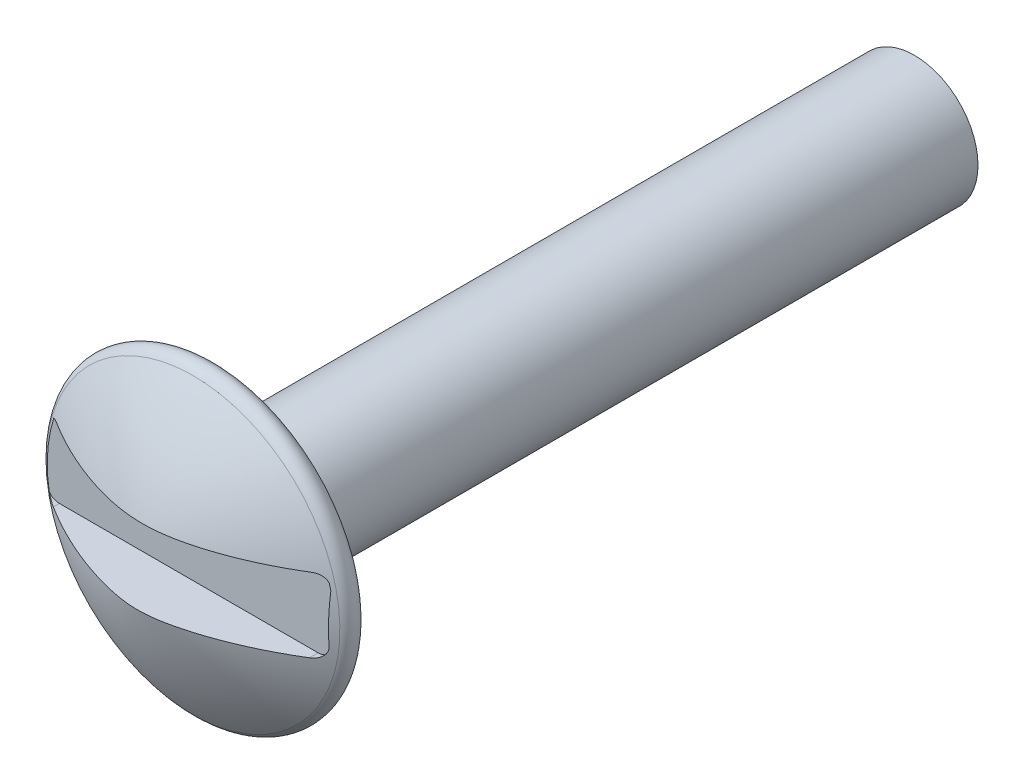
SolidWorks part; units mm, degrees
ref_plane "Front Plane" through (0, 0, 0) normal (0, 0, 1) x (1, 0, 0)
ref_plane "Top Plane" through (0, 0, 0) normal (0, 1, 0) x (1, 0, 0)
ref_plane "Right Plane" through (0, 0, 0) normal (1, 0, 0) x (0, 0, -1)
sketch "Sketch1" plane through (0, 0, 0) normal (0, 0, 1) x (1, 0, 0)
  circle A0 centre (0, 0) radius 5
  dimension "D1" = 10
extrude "Boss-Extrude1" add sketch "Sketch1" along normal blind 55
sketch "Sketch2" plane through (0, 0, 0) normal (1, 0, 0) x (0, 0, -1)
  line L0 (-49.7533, 0) -> (-66.1924, 0) construction
  line L1 (-55, 0) -> (-55, 10.9902)
  line L2 (-55, 5) -> (-55, -5) construction
  line L3 (-61.6895, 0) -> (-55, 0)
  arc A0 (-56.8188, 11.5642) -> (-55, 10.9902) centre (-56, 10.9902) cw
  spline S0 degree 3 poles (-61.6895, 0) (-60.9035, 4.183) (-59.2631, 8.0779) (-56.8188, 11.5642) knots 0 0 0 0 0.812857 0.812857 0.812857 0.812857
  dimension "D1" = 1
revolve "Revolve1" add sketch "Sketch2" angle 360 about L0
ref_plane "Plane1" through (0, 0, 80) normal (0, 0, 1) x (1, 0, 0)
sketch "Sketch3" plane through (0, 0, 80) normal (0, 0, 1) x (1, 0, 0)
  line L1 (10.0303, 3.4734) -> (-10.345, 3.4734)
  line L2 (11.0303, 2.4734) -> (11.0303, -1.241)
  line L3 (10.0303, -2.241) -> (-10.345, -2.241)
  line L4 (-11.345, 2.4734) -> (-11.345, -1.241)
  circle A0 centre (0, 0) radius 11.5642 construction
  arc A1 (-11.345, 2.4734) -> (-10.345, 3.4734) centre (-10.345, 2.4734) cw
  arc A2 (-11.345, -1.241) -> (-10.345, -2.241) centre (-10.345, -1.241) ccw
  arc A3 (10.0303, -2.241) -> (11.0303, -1.241) centre (10.0303, -1.241) ccw
  arc A4 (10.0303, 3.4734) -> (11.0303, 2.4734) centre (10.0303, 2.4734) cw
  point P10 (-11.345, -2.241)
  point P15 (11.0303, 3.4734)
  dimension "D1" = 1
extrude "Cut-Extrude1" cut sketch "Sketch3" against normal blind 23
